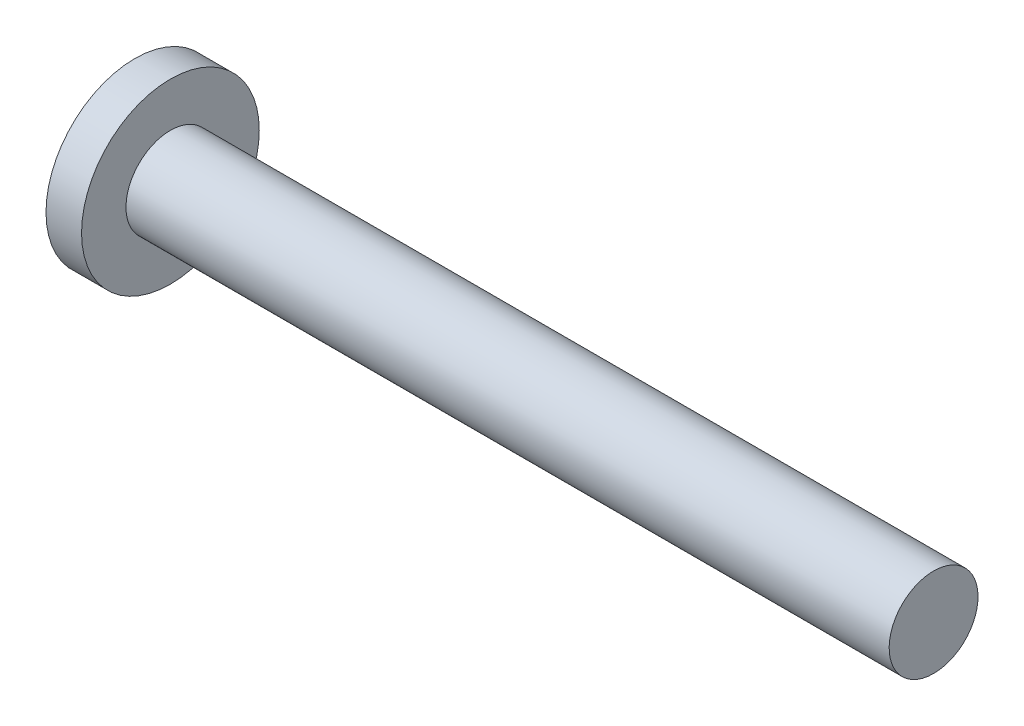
SolidWorks part; units mm, degrees
ref_plane "Front Plane" through (0, 0, 0) normal (0, 0, 1) x (1, 0, 0)
ref_plane "Top Plane" through (0, 0, 0) normal (0, 1, 0) x (1, 0, 0)
ref_plane "Right Plane" through (0, 0, 0) normal (1, 0, 0) x (0, 0, -1)
sketch "Sketch1" plane through (0, 0, 0) normal (0, 0, 1) x (1, 0, 0)
  line L0 (0, 0) -> (0, 3.3909)
  line L1 (0, 3.3909) -> (1.3564, 3.3909)
  line L2 (1.3564, 3.3909) -> (1.3564, 1.6954)
  line L3 (1.3564, 1.6954) -> (30.48, 1.6954)
  line L4 (30.48, 1.6954) -> (30.48, 0)
  line L5 (30.48, 0) -> (0, 0)
  line L6 (30.48, 0) -> (0, 0) construction
  dimension "D1" = 1.3564
  dimension "D2" = 30.48
  dimension "D3" = 1.6954
  dimension "D4" = 3.3909
revolve "Revolve1" add sketch "Sketch1" angle 360 about L6
ref_plane "Plane1" through (30.48, 0, 0) normal (1, 0, 0) x (0, 0, -1)
